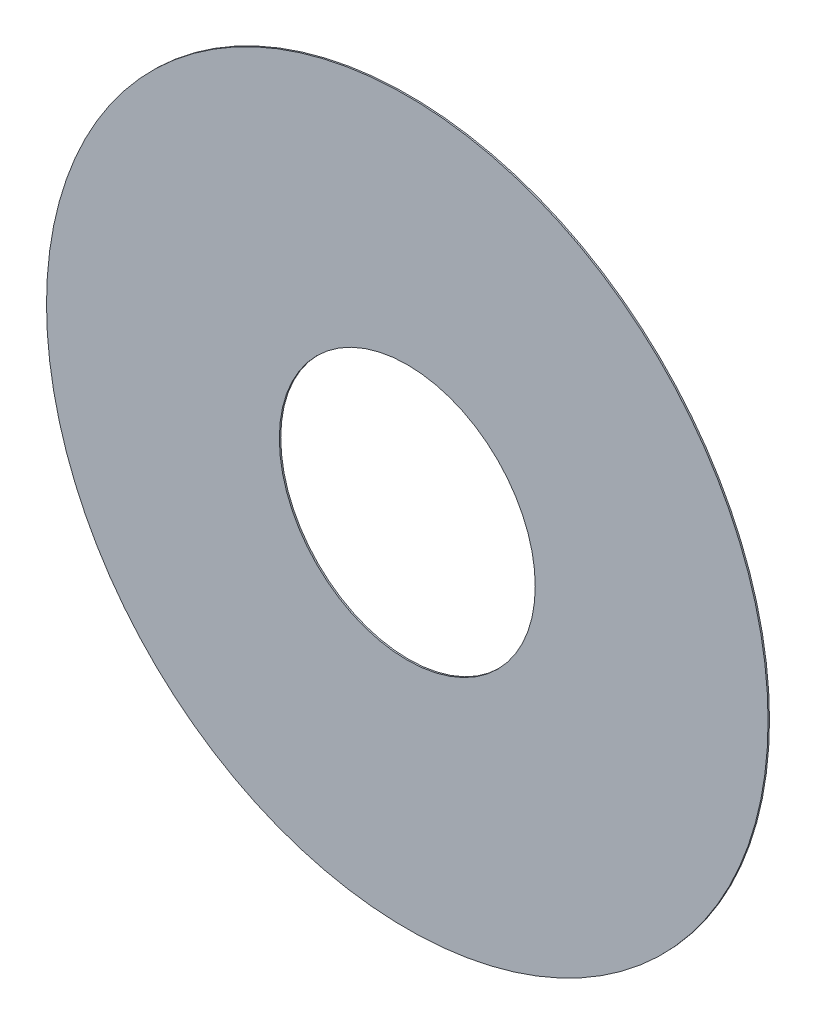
SolidWorks part; units mm, degrees
ref_plane "Front Plane" through (0, 0, 0) normal (0, 0, 1) x (1, 0, 0)
ref_plane "Top Plane" through (0, 0, 0) normal (0, 1, 0) x (1, 0, 0)
ref_plane "Right Plane" through (0, 0, 0) normal (1, 0, 0) x (0, 0, -1)
sketch "Sketch1" plane through (0, 0, 0) normal (0, 0, 1) x (1, 0, 0)
  circle A0 centre (0, 0) radius 507.5
  dimension "OUTER dia" = 1015
base flange "Base-Flange1" sketch "Sketch1" thickness 2 reverse thickness direction no parameters "D1"=1
sketch "Sketch6" plane through (0, 0, 0) normal (0, 0, 1) x (1, 0, 0)
  circle A0 centre (0, 0) radius 180
  dimension "Inner dia" = 360
extrude "Cut-Extrude1" cut sketch "Sketch6" against normal blind 10
sketch "Bend-Lines1" [suppressed] plane through (0, 0, 0) normal (0, 1, 0) x (1, 0, 0)
sketch "Bounding-Box1" [suppressed] plane through (0, 0, 0) normal (0, 1, 0) x (1, 0, 0)
sheet metal parameters "Sheet-Metal1" thickness 2 parameters "D1"=1
flat pattern "Flat-Pattern1"
sketch "Bend-Lines2" plane through (0, 0, 0) normal (0, 1, 0) x (1, 0, 0)
sketch3d "Bounding-Box2" [suppressed]
  line L0 (-507.3263, 507.6734, 0) -> (-507.6735, -507.3261, 0) construction
  line L1 (507.673, 507.3261, 0) -> (507.3258, -507.6734, 0) construction
  line L2 (-507.3263, 507.6734, 0) -> (507.673, 507.3261, 0) construction
  line L3 (-507.6735, -507.3261, 0) -> (507.3258, -507.6734, 0) construction
sheet metal parameters "Sheet-Metal2" thickness 2 parameters "D1"=1
flat pattern "Flat-Pattern1"
sketch "Bend-Lines2" plane through (0, 0, 0) normal (0, 1, 0) x (1, 0, 0)
sketch3d "Bounding-Box2" [suppressed]
  line L0 (507.3263, 507.6734, 0) -> (507.6735, -507.3261, 0) construction
  line L1 (-507.673, 507.3261, 0) -> (-507.3258, -507.6734, 0) construction
  line L2 (507.3263, 507.6734, 0) -> (-507.673, 507.3261, 0) construction
  line L3 (507.6735, -507.3261, 0) -> (-507.3258, -507.6734, 0) construction
equation "\"Inner Dia 1\"= 360"
equation "\"Inner Dia 1.1\"= 370"
equation "\"Outer Dia 1\"= 1015"
equation "\"Outer Dia 1.1\"= 1025"
